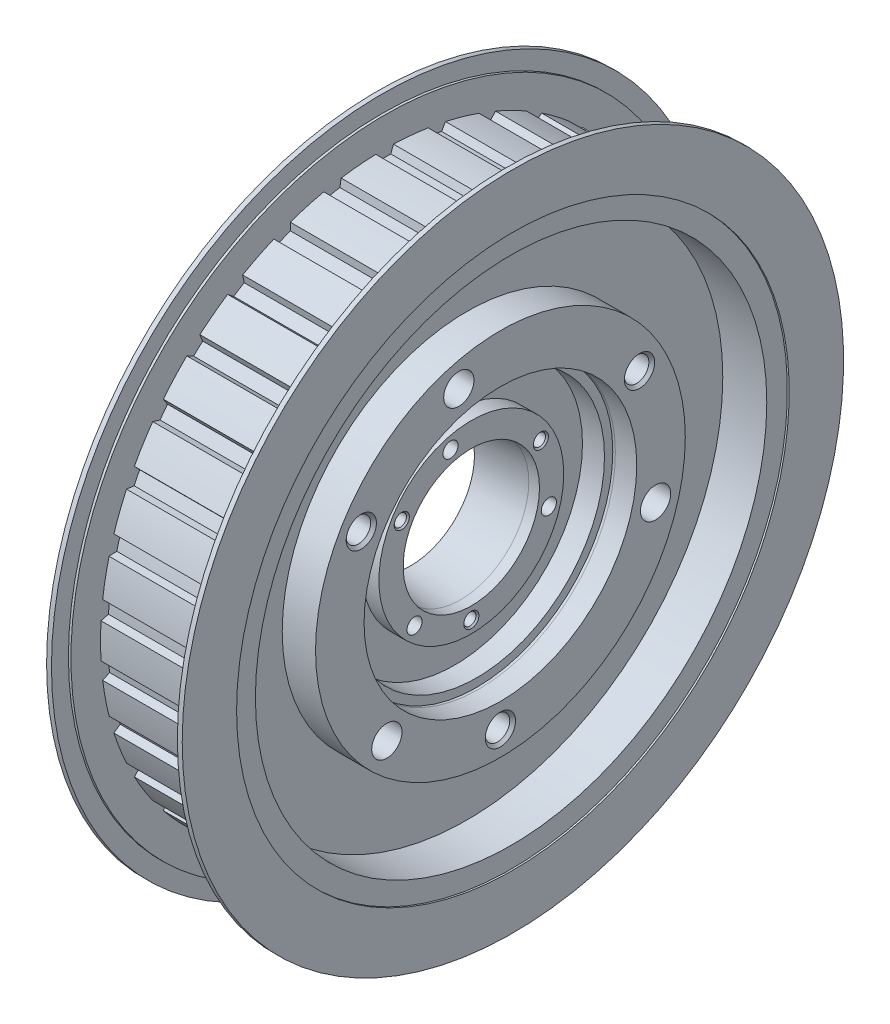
SolidWorks part; units mm, degrees
other "482213"
ref_plane "Front Plane" through (0, 0, 0) normal (0, 0, 1) x (1, 0, 0)
ref_plane "Top Plane" through (0, 0, 0) normal (0, 1, 0) x (1, 0, 0)
ref_plane "Right Plane" through (0, 0, 0) normal (1, 0, 0) x (0, 0, -1)
imported_body "482213.stp<1>"
scale "Scale1" scale about centroid uniform scaling yes scale factor 2
sketch "Sketch1" plane through (-33.7882, 0, 0) normal (-1, 0, 0) x (0, 0, 1)
  circle A0 centre (0, 0) radius 144.6403
  circle A1 centre (0, 0) radius 133.8453 construction
  dimension "D1" = 10.795
extrude "Cut-Extrude1" cut sketch "Sketch1" against normal blind 1.5875 contours A0 M3
ref_plane "Plane1" through (0.7558, 0, 0) normal (-1, 0, 0) x (0, 0, 1)
mirror "Mirror1" about plane through (0.7558, 0, 0) normal (-1, 0, 0) of "Cut-Extrude1"
sketch "Sketch2" plane through (-32.2007, 0, 0) normal (-1, 0, 0) x (0, 0, 1)
  circle A2 centre (0, 0) radius 173.101
  circle A3 centre (0, 0) radius 173.101
  dimension "D1" = 8.89
extrude "Boss-Extrude1" add sketch "Sketch2" along normal blind 2.54 separate body contours M3 M2 | A3 M3
mirror "Mirror4" about plane through (0.7558, 0, 0) normal (-1, 0, 0)
